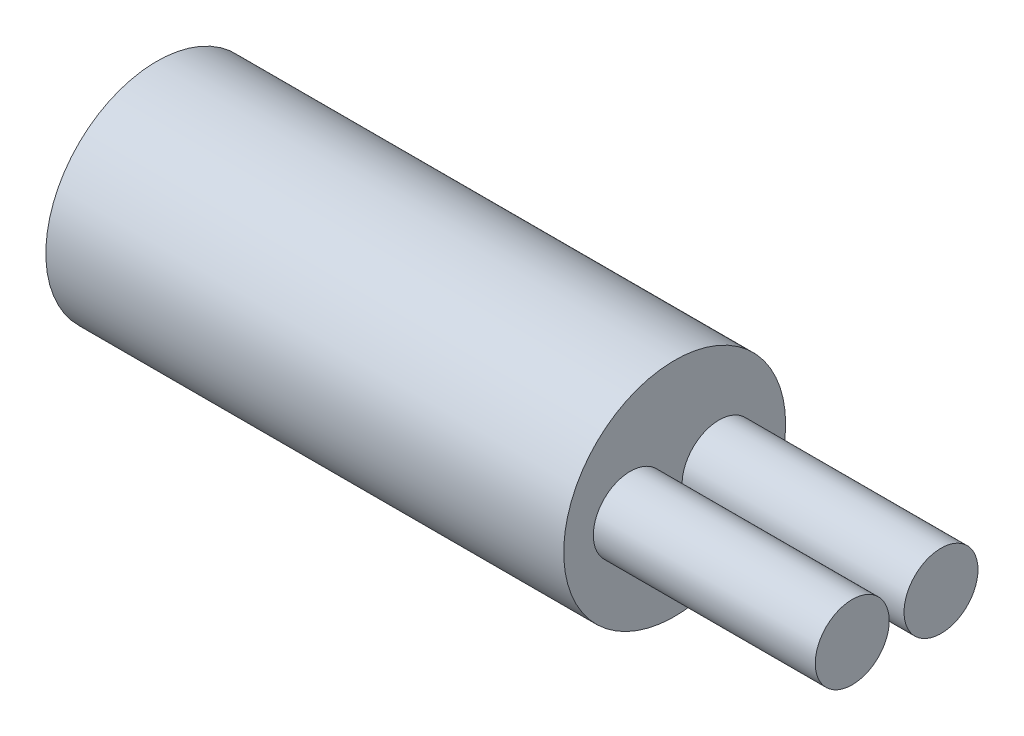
SolidWorks part; units mm, degrees
ref_plane "Ebene vorne" through (0, 0, 0) normal (0, 0, 1) x (1, 0, 0)
ref_plane "Ebene oben" through (0, 0, 0) normal (0, 1, 0) x (1, 0, 0)
ref_plane "Ebene rechts" through (0, 0, 0) normal (1, 0, 0) x (0, 0, -1)
sketch "Skizze1" plane through (0, 0, 0) normal (1, 0, 0) x (0, 0, -1)
  circle A0 centre (0, 0) radius 1.5
  dimension "D1" = 3
extrude "Aufsatz-Linear austragen1" add sketch "Skizze1" against normal blind 7
sketch "Skizze2" plane through (0, 0, 0) normal (1, 0, 0) x (0, 0, -1)
  circle A0 centre (-0.6, 0) radius 0.5
  circle A1 centre (0.6, 0) radius 0.5
  dimension "D1" = 1
  dimension "D2" = 0.6
  dimension "D3" = 0.6
extrude "Aufsatz-Linear austragen2" add sketch "Skizze2" along normal blind 3
